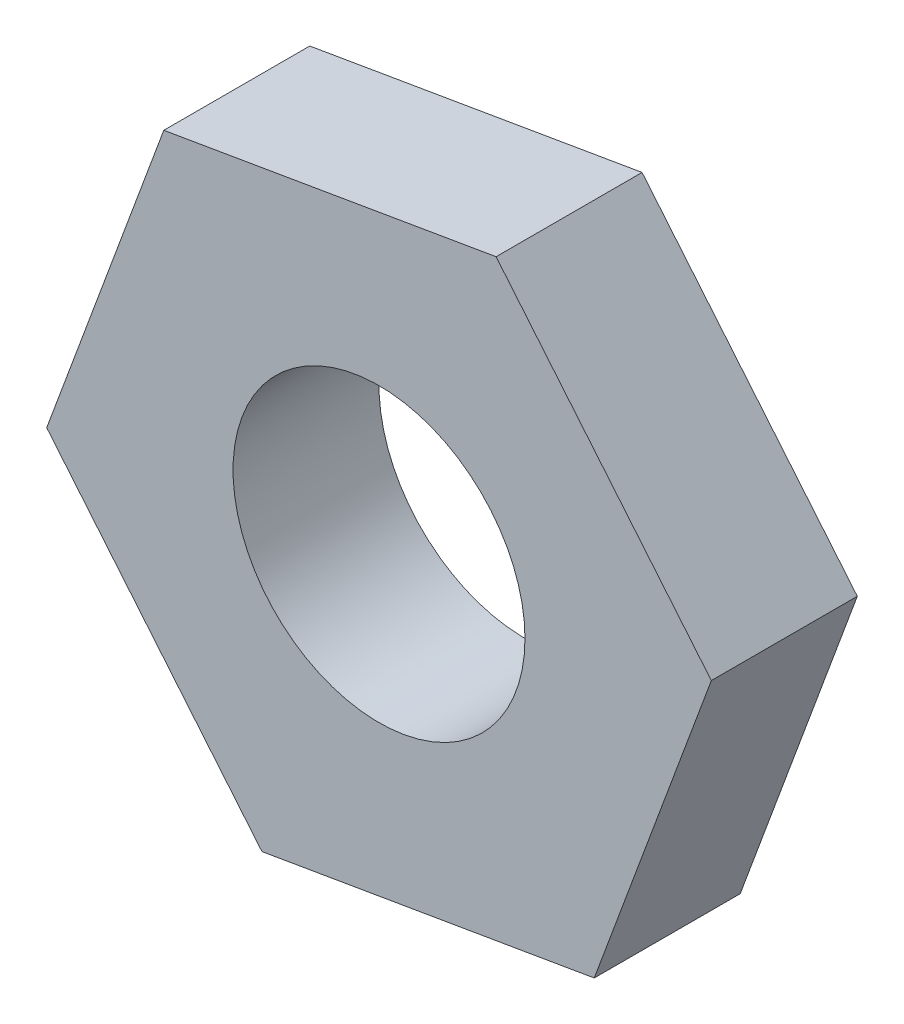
SolidWorks part; units mm, degrees
ref_plane "Plan de face" through (0, 0, 0) normal (0, 0, 1) x (1, 0, 0)
ref_plane "Plan de dessus" through (0, 0, 0) normal (0, 1, 0) x (1, 0, 0)
ref_plane "Plan de droite" through (0, 0, 0) normal (1, 0, 0) x (0, 0, -1)
sketch "Esquisse1" plane through (0, 0, 0) normal (0, 0, 1) x (1, 0, 0)
  line L1 (-2.2117, 2.6662) -> (-3.4148, -0.5823)
  line L2 (-3.4148, -0.5823) -> (-1.2032, -3.2484)
  line L3 (-1.2032, -3.2484) -> (2.2117, -2.6662)
  line L4 (2.2117, -2.6662) -> (3.4148, 0.5823)
  line L5 (3.4148, 0.5823) -> (1.2032, 3.2484)
  line L6 (1.2032, 3.2484) -> (-2.2117, 2.6662)
  circle A0 centre (0, 0) radius 3 construction
  circle A1 centre (0, 0) radius 1.5
extrude "Extrusion1" add sketch "Esquisse1" along normal blind 1.5
